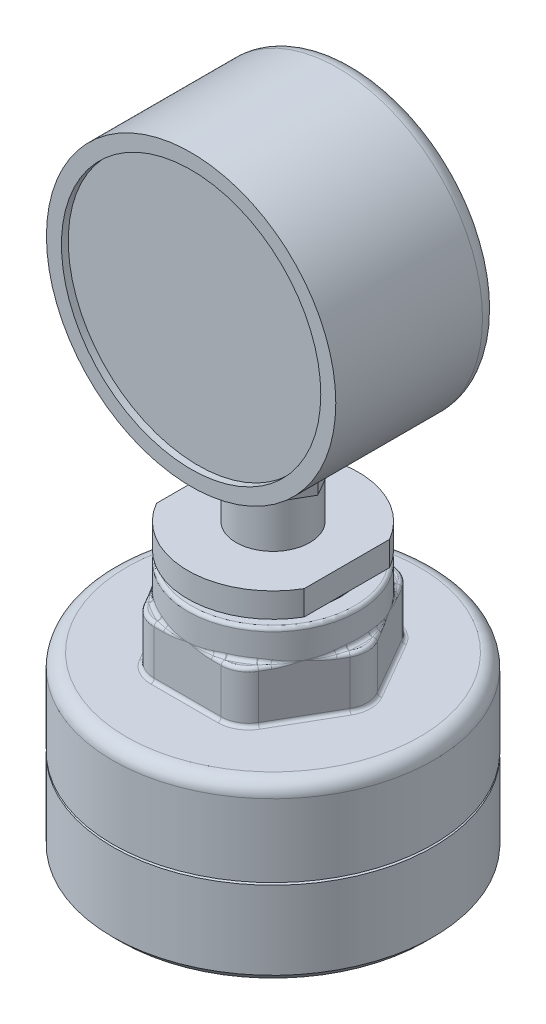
SolidWorks part; units mm, degrees
ref_plane "Front Plane" through (0, 0, 0) normal (0, 0, 1) x (1, 0, 0)
ref_plane "Top Plane" through (0, 0, 0) normal (0, 1, 0) x (1, 0, 0)
ref_plane "Right Plane" through (0, 0, 0) normal (1, 0, 0) x (0, 0, -1)
sketch "Sketch1" plane through (0, 0, 0) normal (0, 1, 0) x (1, 0, 0)
  circle A0 centre (0, 0) radius 29.845
  dimension "D1" = 59.69
extrude "Boss-Extrude1" add sketch "Sketch1" along normal blind 32.512
chamfer "Chamfer1" distance 1.524 angle 45 1 edges at (0, 0, 29.845)
sketch "Sketch2" plane through (0, 0, 0) normal (0, 1, 0) x (1, 0, 0)
  line L0 (0, 0) -> (-29.845, 0) construction
  circle A0 centre (0, 0) radius 29.845 construction
  circle A1 centre (0, 0) radius 22.4155 construction
  circle A2 centre (-22.4155, 0) radius 3.9624
  dimension "D1" = 44.831
  dimension "D2" = 7.9248
extrude "Cut-Extrude1" cut sketch "Sketch2" along normal blind 7.9248
pattern_circular "CirPattern1" count 2 over 360 about axis through (0, 0, 0) along (0, 1, 0) of "Cut-Extrude1"
ref_plane "Plane1" through (0, 32.512, 0) normal (0, 1, 0) x (1, 0, 0)
sketch "Sketch3" plane through (0, 32.512, 0) normal (0, 1, 0) x (1, 0, 0)
  line L1 (-18.3309, 0) -> (-9.1654, -15.875)
  line L2 (-9.1654, -15.875) -> (9.1654, -15.875)
  line L3 (9.1654, -15.875) -> (18.3309, 0)
  line L4 (18.3309, 0) -> (9.1654, 15.875)
  line L5 (9.1654, 15.875) -> (-9.1654, 15.875)
  line L6 (-9.1654, 15.875) -> (-18.3309, 0)
  circle A0 centre (0, 0) radius 15.875 construction
extrude "Boss-Extrude2" add sketch "Sketch3" along normal blind 9.525
fillet "Fillet1" radius 5.08 6 edges at (9.1654, 37.2745, 15.875) (18.3309, 37.2745, 0) (9.1654, 37.2745, -15.875) (-9.1654, 37.2745, -15.875) (-18.3309, 37.2745, 0) (-9.1654, 37.2745, 15.875)
fillet "Fillet2" radius 2.54 1 edges at (0, 32.512, 29.845)
sketch "Sketch4" plane through (0, 32.512, 0) normal (0, 1, 0) x (1, 0, 0)
  circle A0 centre (0, 0) radius 15.875
extrude "Boss-Extrude3" add sketch "Sketch4" along normal blind 15.113
fillet "Fillet5" radius 0.635 1 edges at (0, 47.625, 15.875)
fillet "Fillet6" radius 0.635 12 edges at (13.7482, 32.512, 7.9375) (8.7725, 32.512, 15.1944) (0, 32.512, 15.875) (-8.7725, 32.512, 15.1944) (-13.7482, 32.512, 7.9375) (-17.545, 32.512, 0) (-13.7482, 32.512, -7.9375) (-8.7725, 32.512, -15.1944) (0, 32.512, -15.875) (8.7725, 32.512, -15.1944) (17.545, 32.512, 0) (13.7482, 32.512, -7.9375)
fillet "Fillet7" radius 0.635 18 edges at (-12.19, 42.037, 10.6363) (-15.3063, 42.037, 5.2388) (-17.545, 42.037, 0) (-15.3063, 42.037, -5.2388) (-12.19, 42.037, -10.6363) (-8.7725, 42.037, -15.1944) (-3.1162, 42.037, -15.875) (3.1162, 42.037, -15.875) (8.7725, 42.037, -15.1944) (12.19, 42.037, -10.6363) (15.3063, 42.037, -5.2388) (17.545, 42.037, 0) (15.3063, 42.037, 5.2387) (12.19, 42.037, 10.6363) (8.7725, 42.037, 15.1944) (3.1162, 42.037, 15.875) (-3.1162, 42.037, 15.875) (-8.7725, 42.037, 15.1944)
fillet "Fillet8" radius 0.635 18 edges at (-2.2451, 42.037, 15.7154) (2.2451, 42.037, 15.7154) (7.9375, 42.037, 13.7482) (12.4874, 42.037, 9.802) (14.7325, 42.037, 5.9134) (15.875, 42.037, 0) (14.7325, 42.037, -5.9134) (12.4874, 42.037, -9.802) (7.9375, 42.037, -13.7482) (2.2451, 42.037, -15.7154) (-2.2451, 42.037, -15.7154) (-7.9375, 42.037, -13.7482) (-12.4874, 42.037, -9.802) (-14.7325, 42.037, -5.9134) (-15.875, 42.037, 0) (-14.7325, 42.037, 5.9134) (-12.4874, 42.037, 9.802) (-7.9375, 42.037, 13.7482)
ref_plane "Plane2" through (0, 53.594, 0) normal (0, 1, 0) x (1, 0, 0)
sketch "Sketch9" plane through (0, 53.594, 0) normal (0, 1, 0) x (1, 0, 0)
  line L2 (-13.7482, 7.9375) -> (-13.7482, -7.9375)
  line L3 (13.7482, -7.9375) -> (13.7482, 7.9375)
  arc A1 (-13.7482, 7.9375) -> (13.7482, 7.9375) centre (0, 0) cw
  arc A2 (-13.7482, -7.9375) -> (13.7482, -7.9375) centre (0, 0) ccw
extrude "Boss-Extrude4" add sketch "Sketch9" against normal blind 4.572 separate body
sketch "Sketch10" plane through (0, 53.594, 0) normal (0, 1, 0) x (1, 0, 0)
  circle A0 centre (0, 0) radius 11.1125
  dimension "D1" = 22.225
extrude "Boss-Extrude5" add sketch "Sketch10" against normal blind 9.525
sketch "Sketch11" plane through (0, 0, 0) normal (0, 1, 0) x (1, 0, 0)
  circle A0 centre (0, 0) radius 6.858
  dimension "D1" = 13.716
extrude "Boss-Extrude6" add sketch "Sketch11" along normal blind 93.726
sketch "Sketch12" plane through (0, 0, 0) normal (0, 0, 1) x (1, 0, 0)
  line L0 (6.858, 93.726) -> (-6.858, 93.726) construction
  circle A0 centre (0, 93.726) radius 26.924
  dimension "D1" = 53.848
extrude "Boss-Extrude7" add sketch "Sketch12" along normal mid plane 30.48
fillet "Fillet9" radius 3.175 1 edges at (26.924, 93.726, -15.24)
ref_plane "Plane3" through (0, 0, 15.24) normal (0, 0, 1) x (1, 0, 0)
sketch "Sketch13" plane through (0, 0, 15.24) normal (0, 0, 1) x (1, 0, 0)
  circle A0 centre (0, 93.726) radius 24.13
  dimension "D1" = 48.26
extrude "Cut-Extrude2" cut sketch "Sketch13" against normal blind 1.27
ref_plane "Plane4" through (0, 93.726, 0) normal (0, 1, 0) x (1, 0, 0)
sketch "Sketch14" plane through (0, 93.726, 0) normal (0, 1, 0) x (1, 0, 0)
  line L1 (-8.3348, 0) -> (-4.1674, -7.2181)
  line L2 (-4.1674, -7.2181) -> (4.1674, -7.2181)
  line L3 (4.1674, -7.2181) -> (8.3348, 0)
  line L4 (8.3348, 0) -> (4.1674, 7.2181)
  line L5 (4.1674, 7.2181) -> (-4.1674, 7.2181)
  line L6 (-4.1674, 7.2181) -> (-8.3348, 0)
  circle A0 centre (0, 0) radius 7.2181 construction
extrude "Boss-Extrude8" add sketch "Sketch14" against normal blind 31.75
hole_wizard "1/2 NPT Tapped Hole1" positions "Sketch16" profile "Sketch15" size "1/2" standard "ANSI Inch"
sketch "Sketch16" plane through (0, 0, 0) normal (0, 1, 0) x (1, 0, 0)
  point P0 (0, 0)
sketch "Sketch15" plane through (0, 0, 0) normal (1, 0, 0) x (0, 0, -1)
  line L0 (0, 0) -> (0, 27.9705)
  line L1 (8.9281, 22.606) -> (0, 27.9705)
  line L2 (-8.9281, 22.606) -> (0, 27.9705) construction
  line L3 (8.9281, 22.606) -> (8.9281, 13.462)
  line L4 (8.9281, 13.462) -> (9.4797, 13.462)
  line L5 (9.4797, 13.462) -> (9.8828, 0)
  line L6 (-9.4797, 13.462) -> (-9.8828, 0) construction
  line L7 (9.8828, 0) -> (0, 0)
  line L8 (0, -6.35) -> (0, 107.95) construction
  line L11 (-8.9281, 13.462) -> (-9.4797, 13.462) construction
  dimension "Tap Drill Dia." = 17.8562
  dimension "Tap Drill Depth" = 22.606
  dimension "Thread Dia." = 19.7656
  dimension "Thread Angle" = 3.43
  dimension "Thread Depth" = 13.462
  dimension "Drill Angle" = 118
sketch "Sketch17" plane through (0, 0, 0) normal (0, 0, 1) x (1, 0, 0)
  line L0 (0, 0) -> (0, 93.726) construction
  line L2 (-11.938, 49.022) -> (-11.938, 47.625) construction
  line L3 (15.24, 47.625) -> (-15.24, 47.625) construction
  line L4 (-13.7482, 49.022) -> (13.7482, 49.022) construction
  circle A0 centre (-11.938, 48.3235) radius 0.889
  dimension "D2" = 1.778
  dimension "D1" = 11.938
revolve "Revolve1" add sketch "Sketch17" angle 360 about L0
sketch "Sketch18" plane through (0, 0, 0) normal (0, 0, 1) x (1, 0, 0)
  line L0 (-32.5865, 14.91) -> (-29.337, 16.256)
  line L1 (-32.5865, 17.602) -> (-32.5865, 14.91)
  line L2 (-29.337, 16.256) -> (-32.5865, 17.602)
  line L3 (0, 0) -> (0, 32.512) construction
  line L4 (27.305, 32.512) -> (-27.305, 32.512) construction
  line L5 (-29.337, 16.256) -> (-37.3255, 16.256) construction
  line L6 (-29.845, 29.972) -> (-29.845, 1.524) construction
  line L7 (-28.321, 0) -> (28.321, 0) construction
  dimension "D1" = 45
  dimension "D2" = 22.5
  dimension "D3" = 0.508
  dimension "D4" = 16.256
revolve "Cut-Revolve1" cut sketch "Sketch18" angle 360 about L3
